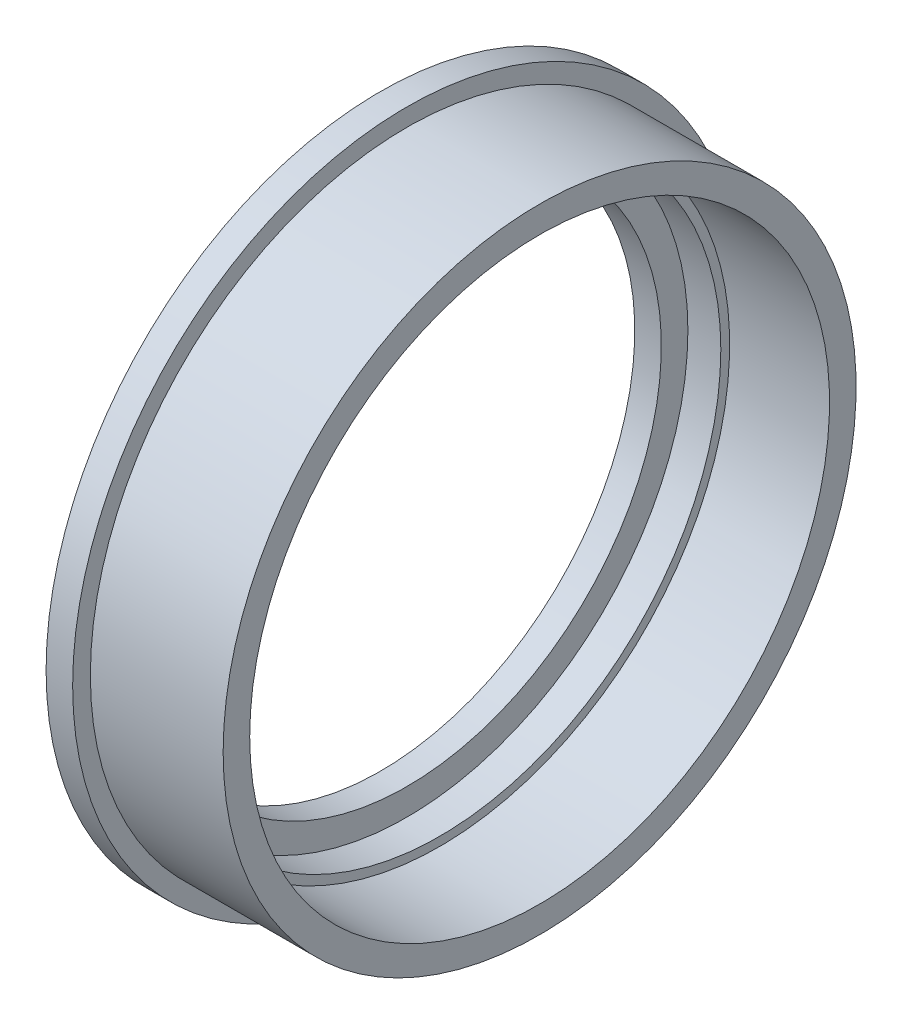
SolidWorks part; units mm, degrees
ref_plane "Front Plane" through (0, 0, 0) normal (0, 0, 1) x (1, 0, 0)
ref_plane "Top Plane" through (0, 0, 0) normal (0, 1, 0) x (1, 0, 0)
ref_plane "Right Plane" through (0, 0, 0) normal (1, 0, 0) x (0, 0, -1)
sketch "Sketch1" plane through (0, 0, 0) normal (0, 0, 1) x (1, 0, 0)
  line L0 (12.7, 31.75) -> (0, 31.75) construction
  line L1 (3.7185, 31.75) -> (0, 31.75)
  line L2 (0, 31.75) -> (0, 28.75)
  line L3 (0, 31.75) -> (0, -31.75) construction
  line L4 (0, 28.75) -> (-3, 28.75)
  line L5 (-3, 28.75) -> (-3, 37.75)
  line L6 (-3, 37.75) -> (0, 37.75)
  line L7 (0, 37.75) -> (0, 35.75)
  line L8 (0, 35.75) -> (15, 35.75)
  line L9 (15, 35.75) -> (15, 32.75)
  line L10 (15, 32.75) -> (3.7185, 32.75)
  line L11 (3.7185, 32.75) -> (3.7185, 31.75)
  line L12 (0, 0) -> (34.4115, 0) construction
revolve "Revolve1" add sketch "Sketch1" angle 360 about L12
